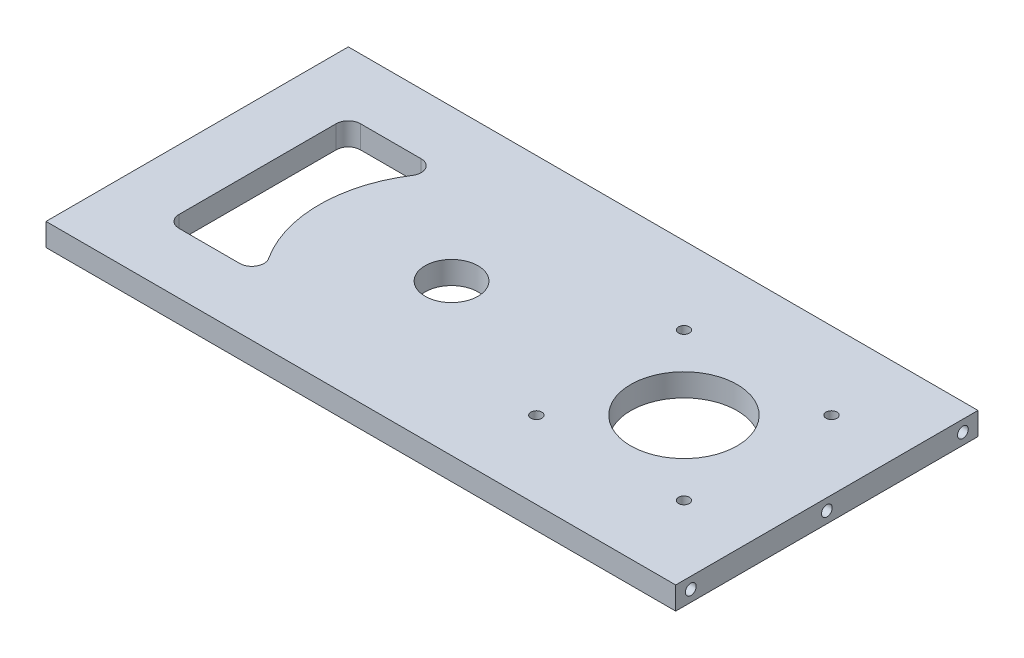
SolidWorks part; units mm, degrees
ref_plane "Front Plane" through (0, 0, 0) normal (0, 0, 1) x (1, 0, 0)
ref_plane "Top Plane" through (0, 0, 0) normal (0, 1, 0) x (1, 0, 0)
ref_plane "Right Plane" through (0, 0, 0) normal (1, 0, 0) x (0, 0, -1)
sketch "Sketch1" plane through (0, 0, 0) normal (0, 1, 0) x (1, 0, 0)
  line L1 (-66.1353, -31.75) -> (66.1352, -31.75)
  line L2 (-66.1353, -31.75) -> (-66.1353, 31.75)
  line L3 (-66.1353, 31.75) -> (66.1352, 31.75)
  line L4 (66.1352, -31.75) -> (66.1352, 31.75)
  line L5 (-66.1353, -31.75) -> (66.1352, 31.75) construction
  line L6 (-66.1353, 31.75) -> (66.1352, -31.75) construction
  point P0 (0, 0)
  dimension "D1" = 132.2705
  dimension "D2" = 63.5
extrude "Boss-Extrude1" add sketch "Sketch1" along normal blind 4.7625
sketch "Sketch2" plane through (-66.1353, 0, 0) normal (-1, 0, 0) x (0, 0, 1)
  line L0 (0, 4.7625) -> (0, 0) construction
  line L1 (-31.75, 4.7625) -> (31.75, 4.7625) construction
  line L2 (-31.75, 4.7625) -> (-31.75, 0) construction
  line L3 (-31.75, 2.3813) -> (31.75, 2.3813) construction
  line L4 (31.75, 4.7625) -> (31.75, 0) construction
  circle A0 centre (-28.575, 2.3813) radius 1.1303
  circle A1 centre (28.575, 2.3813) radius 1.1303
  circle A2 centre (0, 2.3813) radius 1.1303
  dimension "D1" = 2.2606
  dimension "D3" = 28.575
  dimension "D2" = 3.175
extrude "Cut-Extrude1" cut sketch "Sketch2" against normal blind 10.16
mirror "Mirror1" about plane through (0, 0, 0) normal (1, 0, 0) of "Cut-Extrude1"
sketch "Sketch3" plane through (0, 4.7625, 0) normal (0, 1, 0) x (1, 0, 0)
  circle A0 centre (-12.7, 0) radius 5.5562
  dimension "D1" = 11.1125
  dimension "D2" = 12.7
extrude "Cut-Extrude2" cut sketch "Sketch3" against normal through all
sketch "Sketch4" plane through (0, 4.7625, 0) normal (0, 1, 0) x (1, 0, 0)
  line L1 (20.6163, -15.5) -> (51.6163, -15.5) construction
  line L2 (20.6163, -15.5) -> (20.6163, 15.5) construction
  line L3 (20.6163, 15.5) -> (51.6163, 15.5) construction
  line L4 (51.6163, -15.5) -> (51.6163, 15.5) construction
  line L5 (20.6163, -15.5) -> (51.6163, 15.5) construction
  line L6 (20.6163, 15.5) -> (51.6163, -15.5) construction
  circle A0 centre (36.1163, 0) radius 11.176
  circle A1 centre (-12.7, 0) radius 5.5562 construction
  circle A2 centre (20.6163, 15.5) radius 1.143
  circle A3 centre (51.6163, 15.5) radius 1.143
  circle A4 centre (51.6163, -15.5) radius 1.143
  circle A5 centre (20.6163, -15.5) radius 1.143
  dimension "D1" = 22.352
  dimension "D2" = 48.8163
  dimension "D3" = 2.286
  dimension "D4" = 31
extrude "Cut-Extrude3" cut sketch "Sketch4" against normal through all
sketch "Sketch5" plane through (0, 4.7625, 0) normal (0, 1, 0) x (1, 0, 0)
  line L0 (-66.1353, -31.75) -> (66.1352, -31.75) construction
  line L2 (-66.1353, 31.75) -> (-66.1353, -31.75) construction
  line L4 (-66.1353, 31.75) -> (-66.1353, -31.75) construction
  line L5 (-66.1353, -31.75) -> (66.1352, -31.75) construction
  line L7 (-53.4353, 19.05) -> (-53.4352, -19.05)
  line L8 (-53.4352, -19.05) -> (-32.9212, -19.05)
  line L9 (-32.9212, 19.05) -> (-53.4353, 19.05)
  line L10 (44.5217, 19.05) -> (-53.4353, 19.05) construction
  line L11 (-53.4352, -19.05) -> (66.1352, -19.05) construction
  line L12 (44.5217, 31.75) -> (-66.1353, 31.75) construction
  arc A0 (-32.9212, 19.05) -> (-32.9212, -19.05) centre (-12.7, 0) ccw
  dimension "D1" = 55.5625
  dimension "D2" = 12.7
extrude "Cut-Extrude4" cut sketch "Sketch5" against normal through all
fillet "Fillet1" radius 2.54 4 edges at (-53.4352, 2.3813, 19.05) (-32.9212, 2.3813, 19.05) (-32.9212, 2.3813, -19.05) (-53.4353, 2.3813, -19.05)
